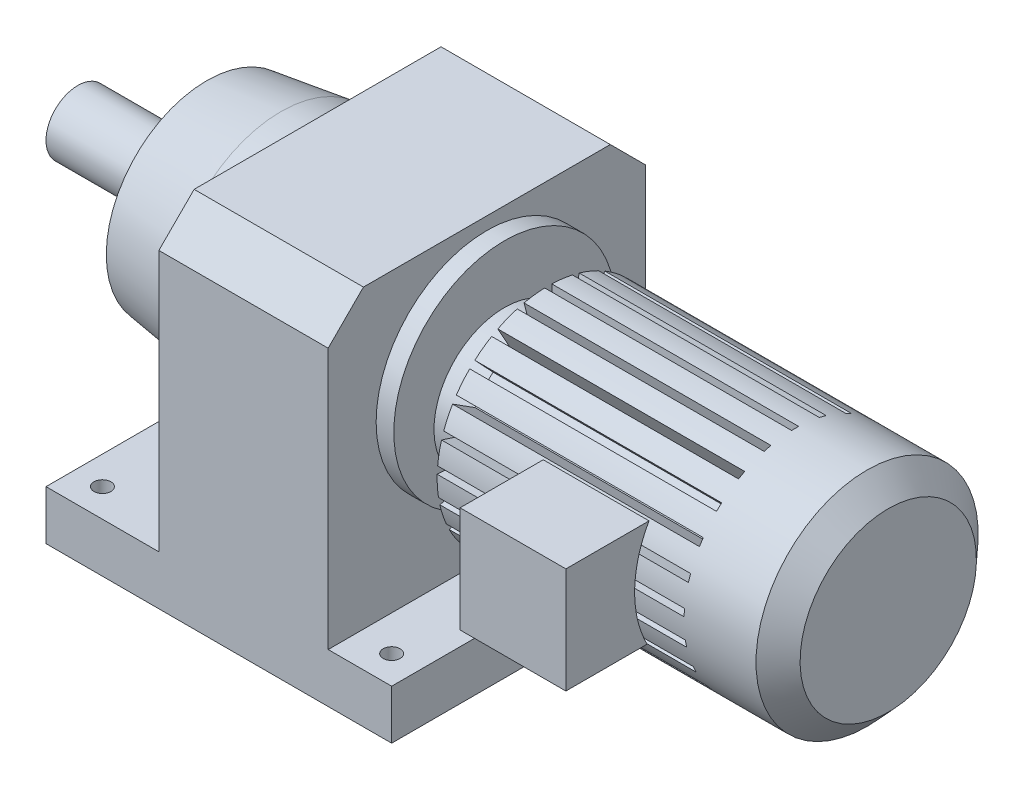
SolidWorks part; units mm, degrees
ref_plane "Front Plane" through (0, 0, 0) normal (0, 0, 1) x (1, 0, 0)
ref_plane "Top Plane" through (0, 0, 0) normal (0, 1, 0) x (1, 0, 0)
ref_plane "Right Plane" through (0, 0, 0) normal (1, 0, 0) x (0, 0, -1)
sketch "Sketch1" plane through (0, 0, 0) normal (0, 0, 1) x (1, 0, 0)
  line L0 (-256.2172, 24.0407) -> (-256.2172, 69.0407)
  line L1 (-256.2172, 69.0407) -> (-83.2172, 69.0407)
  line L2 (-83.2172, 69.0407) -> (-83.2172, 139.0407)
  line L3 (-83.2172, 139.0407) -> (-73.2172, 139.0407)
  line L4 (-73.2172, 139.0407) -> (-73.2172, 166.5917)
  line L5 (-73.2172, 166.5917) -> (31.7828, 181.0407)
  line L6 (31.7828, 181.0407) -> (348.7828, 181.0407)
  line L7 (348.7828, 181.0407) -> (348.7828, 24.0407)
  line L13 (348.7828, 24.0407) -> (-256.2172, 24.0407)
  dimension "D1" = 605
  dimension "D2" = 45
  dimension "D3" = 173
  dimension "D4" = 10
  dimension "D5" = 105
  dimension "D6" = 157
  dimension "D7" = 115
revolve "Revolve1" add sketch "Sketch1" angle 360 about L13
sketch "Sketch2" plane through (0, 0, 0) normal (0, 0, 1) x (1, 0, 0)
  line L0 (348.7828, -0.9593) -> (348.7828, 99.0407)
  line L1 (348.7828, -132.9593) -> (348.7828, 181.0407) construction
  line L2 (348.7828, 99.0407) -> (410.7828, 99.0407)
  line L3 (410.7828, 99.0407) -> (410.7828, 156.5407)
  line L4 (410.7828, 156.5407) -> (862.7828, 156.5407)
  line L5 (862.7828, 156.5407) -> (892.7828, 124.0407)
  line L6 (892.7828, 124.0407) -> (892.7828, -0.9593)
  line L7 (892.7828, -0.9593) -> (348.7828, -0.9593)
  line L8 (-256.2172, 24.0407) -> (348.7828, 24.0407) construction
  line L9 (-256.2172, 69.0407) -> (-256.2172, -20.9593) construction
  dimension "D1" = 25
  dimension "D2" = 544
  dimension "D3" = 157.5
  dimension "D4" = 100
  dimension "D5" = 62
  dimension "D6" = 30
  dimension "D7" = 125
revolve "Revolve2" add sketch "Sketch2" angle 360 about L7
sketch "Sketch3" plane through (0, 0, 0) normal (0, 0, 1) x (1, 0, 0)
  line L0 (-256.2172, 69.0407) -> (-256.2172, -20.9593) construction
  line L1 (-76.2172, -290.9593) -> (413.7828, -290.9593)
  line L2 (-76.2172, -290.9593) -> (-76.2172, -220.9593)
  line L3 (-76.2172, -220.9593) -> (83.7828, -220.9593)
  line L4 (413.7828, -290.9593) -> (413.7828, -220.9593)
  line L5 (-256.2172, 24.0407) -> (892.7828, 24.0407) construction
  line L6 (892.7828, -125.9593) -> (892.7828, 124.0407) construction
  line L7 (83.7828, -220.9593) -> (83.7828, 199.0407)
  line L8 (83.7828, 199.0407) -> (323.7828, 199.0407)
  line L9 (323.7828, 199.0407) -> (323.7828, -220.9593)
  line L10 (323.7828, -220.9593) -> (413.7828, -220.9593)
  dimension "D1" = 180
  dimension "D2" = 490
  dimension "D3" = 70
  dimension "D4" = 315
  dimension "D5" = 420
  dimension "D6" = 160
  dimension "D7" = 90
extrude "Boss-Extrude1" add sketch "Sketch3" along normal mid plane 450
sketch "Sketch4" plane through (0, 0, 0) normal (0, 0, 1) x (1, 0, 0)
  line L0 (862.7828, 156.5407) -> (410.7828, 156.5407) construction
  line L1 (410.7828, 156.5407) -> (760.7828, 156.5407)
  line L2 (410.7828, 156.5407) -> (410.7828, 118.7178)
  line L3 (410.7828, 118.7178) -> (760.7828, 118.7178)
  line L4 (760.7828, 156.5407) -> (760.7828, 118.7178)
  line L5 (410.7828, 156.5407) -> (410.7828, -158.4593) construction
  dimension "D1" = 350
extrude "Cut-Extrude1" cut sketch "Sketch4" against normal mid plane 10
pattern_circular "CirPattern1" count 25 over 360 about axis through (0, -0.9593, 0) along (1, 0, 0) of "Cut-Extrude1"
chamfer "Chamfer1" distance 50 angle 45 2 edges at (203.7828, 199.0407, -225) (203.7828, 199.0407, 225)
sketch "Sketch5" plane through (0, -220.9593, 0) normal (0, 1, 0) x (1, 0, 0)
  line L0 (413.7828, -225) -> (413.7828, 225) construction
  line L1 (413.7828, -225) -> (323.7828, -225) construction
  circle A0 centre (373.7828, -185) radius 12
  dimension "D1" = 24
  dimension "D2" = 40
  dimension "D3" = 40
extrude "Cut-Extrude2" cut sketch "Sketch5" against normal through all
pattern_linear "LPattern1" count 2 spacing 410 along (-1, 0, 0) count 2 spacing 370 along (0, 0, -1) of "Cut-Extrude2"
ref_plane "Plane1" through (0, 0, 255) normal (0, 0, 1) x (1, 0, 0)
sketch "Sketch7" plane through (0, 0, 255) normal (0, 0, 1) x (1, 0, 0)
  line L0 (410.7828, 1.5651) -> (760.7828, 1.5651) construction
  line L1 (540.7828, -73.4349) -> (690.7828, -73.4349)
  line L2 (540.7828, -73.4349) -> (540.7828, 76.5651)
  line L3 (540.7828, 76.5651) -> (690.7828, 76.5651)
  line L4 (690.7828, -73.4349) -> (690.7828, 76.5651)
  line L5 (540.7828, -73.4349) -> (690.7828, 76.5651) construction
  line L6 (540.7828, 76.5651) -> (690.7828, -73.4349) construction
  line L7 (892.7828, -125.9593) -> (892.7828, 124.0407) construction
  point P0 (615.7828, 1.5651)
  dimension "D1" = 277
  dimension "D2" = 150
  dimension "D3" = 150
extrude "Boss-Extrude2" add sketch "Sketch7" along normal up to surface (115.166 mm away)
